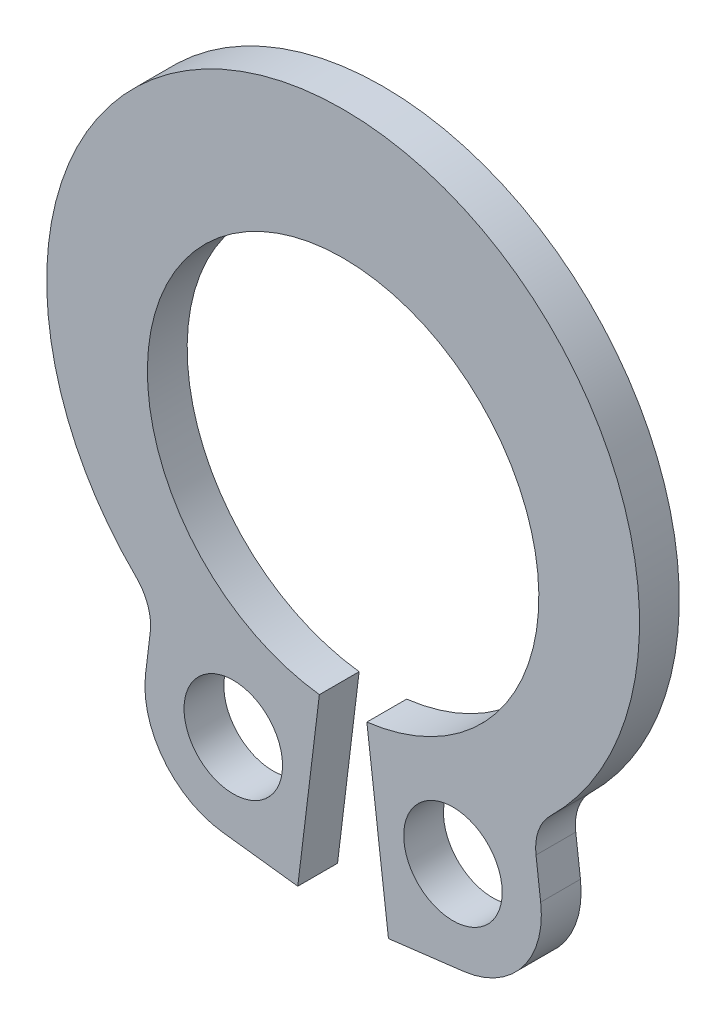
SolidWorks part; units mm, degrees
ref_plane "Plane1" through (0, 0, 0) normal (0, 0, 1) x (1, 0, 0)
ref_plane "Plane2" through (0, 0, 0) normal (0, 1, 0) x (1, 0, 0)
ref_plane "Plane3" through (0, 0, 0) normal (1, 0, 0) x (0, 0, -1)
sketch "Clipboard" plane through (0, 0, 0) normal (0, 0, 1) x (1, 0, 0)
  line L0 (0, 0) -> (1.7272, 0)
  line L1 (0, 0) -> (0, 14.0462)
  line L2 (0, 0) -> (0, -3.5814)
  line L3 (0, 0) -> (-2.54, 0)
  circle A0 centre (0, 0) radius 0.9906
  circle A1 centre (0, 0) radius 3.937
  circle A2 centre (0, 0) radius 3.7846
  dimension "HoleDia" = 1.9812
  dimension "ShaftDia" = 7.874
  dimension "FreeDia" = 7.5692
  dimension "LargeSection" = 1.7272
  dimension "RingHeight" = 14.0462
  dimension "LugSection" = 3.5814
  dimension "LugBasis" = 2.54
sketch "BodySke" plane through (0, 0, 0) normal (0, 0, 1) x (1, 0, 0)
  line L0 (-1.5431, 0) -> (1.5431, 0) construction
  line L1 (0, 0) -> (0, 6.5278) construction
  line L2 (0.4776, -3.9079) -> (0.9121, -7.4629)
  line L3 (-0.4776, -3.9079) -> (-0.9121, -7.4629)
  line L4 (0, 0) -> (3.9235, -3.9235) construction
  line L5 (0, 0) -> (-3.9235, -3.9235) construction
  line L6 (0.9121, -7.4629) -> (2.4248, -7.278)
  line L7 (-0.9121, -7.4629) -> (-2.4248, -7.278)
  line L9 (3.8794, -4.5237) -> (3.974, -5.2974)
  line L14 (-3.8794, -4.5237) -> (-3.974, -5.2974)
  circle A0 centre (0, 0) radius 3.937 construction
  arc A1 (0.4776, -3.9079) -> (-0.4776, -3.9079) centre (0, 0) ccw
  arc A2 (3.9235, -3.9235) -> (-3.9235, -3.9235) centre (0, 0.5657) ccw construction
  arc A3 (-3.974, -5.2974) -> (-2.4248, -7.278) centre (-2.2091, -5.5131) ccw
  arc A4 (-3.8794, -4.5237) -> (-4.1699, -3.6956) centre (-4.8627, -4.4036) ccw
  arc A5 (4.1699, -3.6956) -> (3.8794, -4.5237) centre (4.8627, -4.4036) ccw
  arc A6 (2.4248, -7.278) -> (3.974, -5.2974) centre (2.2091, -5.5131) ccw
  arc A7 (4.1699, -3.6956) -> (-4.1699, -3.6956) centre (0, 0.5657) ccw
  dimension "GrooveDia" = 7.874
  dimension "D2" = 90
  dimension "LugFilletRad" = 1.778
  dimension "BodyFilletRad" = 0.9906
  dimension "LargeRad" = 6.5278
  dimension "SmallRad" = 5.5486
  dimension "LugY" = 7.5184
  dimension "GapAng" = 13.935
  dimension "LugWidth" = 3.302
extrude "Body" add sketch "BodySke" against normal blind 0.8
sketch "HolSke" plane through (0, 0, 0) normal (0, 0, 1) x (1, 0, 0)
  line L0 (0, 0) -> (0, -2.9285) construction
  line L1 (0.9121, -7.4629) -> (2.4248, -7.278) construction
  line L2 (0.4776, -3.9079) -> (0.9121, -7.4629) construction
  circle A0 centre (2.2091, -5.5131) radius 0.9906
  circle A1 centre (-2.2091, -5.5131) radius 0.9906
  dimension "HoleDia" = 1.9812
  dimension "HoleInset" = 1.778
  dimension "HoleOffset" = 1.524
extrude "Holes" cut sketch "HolSke" against normal through all
sketch "NotSke" plane through (0, 0, 0) normal (0, 0, 1) x (1, 0, 0)
  line L2 (0, 0) -> (0, -3.0231) construction
  arc A0 (1.1619, -6.6171) -> (0.8193, -4.6657) centre (0.9906, -5.6414) ccw
  arc A1 (-0.8193, -4.6657) -> (-1.1619, -6.6171) centre (-0.9906, -5.6414) ccw
  arc A2 (-1.9478, -5.3863) -> (1.9478, -5.3863) centre (0, 0) ccw construction
  arc A3 (0.4776, -3.9079) -> (-0.4776, -3.9079) centre (0, 0) ccw construction
  circle A4 centre (0.9906, -5.6414) radius 0.9906 construction
  circle A5 centre (-0.9906, -5.6414) radius 0.9906 construction
  arc A6 (-0.8193, -4.6657) -> (0.8193, -4.6657) centre (0, 0) ccw
  arc A7 (-1.1619, -6.6171) -> (1.1619, -6.6171) centre (0, 0) ccw
  dimension "HoleDia" = 1.9812
  dimension "NotchRad" = 5.7277
extrude "Notch" [suppressed] cut sketch "NotSke" against normal through all
fillet "NotchFillets" [suppressed] radius 0.3903
equation "' \"ShaftDia@Clipboard\" = 0.058"
equation "' \"FreeDia@Clipboard\" = 0.055"
equation "' \"Thickness@Body\" = 0.015"
equation "' \"GrooveDia@BodySke\" = 0.058"
equation "' \"LugSection@Clipboard\" = 0.066"
equation "' \"RingHeight@Clipboard\" = 0.145"
equation "' \"HoleDia@Clipboard\" = 0.035"
equation "' \"LugBasis@Clipboard\" = 0.03"
equation "' \"ShaftDia@Clipboard\" = 0.092"
equation "' \"FreeDia@Clipboard\" = 0.089"
equation "' \"Thickness@Body\" = 0.025"
equation "' \"GrooveDia@BodySke\" = 0.092"
equation "' \"LugSection@Clipboard\" = 0.074"
equation "' \"RingHeight@Clipboard\" = 0.207"
equation "' \"HoleDia@Clipboard\" = 0.034"
equation "' \"LugBasis@Clipboard\" = 0.04"
equation "\"LargeRad@BodySke\" =  \"RingHeight@Clipboard\" - \"GrooveDia@BodySke\" / 2  - \"LugSection@Clipboard\""
equation "\"SmallRad@BodySke\" = \"LargeRad@BodySke\" * 0.85"
equation "\"LugY@BodySke\" =  \"GrooveDia@BodySke\" / 2 +  \"LugSection@Clipboard\" "
equation "\"GapAng@BodySke\" = 360 - 360 * (\"FreeDia@Clipboard\" /  \"GrooveDia@BodySke\" )"
equation "\"HoleDia@NotSke\" = \"HoleDia@Clipboard\""
equation "\"NotchRad@NotSke\" = \"LugY@BodySke\" - \"LugSection@Clipboard\" / 2"
equation "\"Radius@NotchFillets\" = (\"LugSection@Clipboard\" - \"HoleDia@Clipboard\" ) / 4.1"
equation "\"LugWidth@BodySke\" = \"LugBasis@Clipboard\"  * 1.3"
equation "\"LugFilletRad@BodySke\" = \"LugBasis@Clipboard\"  * 0.7"
equation "\"BodyFilletRad@BodySke\" = \"HoleDia@Clipboard\" / 2"
equation "\"HoleOffset@HolSke\" =  \"LugBasis@Clipboard\"  * 0.6"
equation "\"HoleInset@HolSke\" = \"LugBasis@Clipboard\"  * 0.7"
equation "\"HoleDia@HolSke\" = \"HoleDia@Clipboard\""
